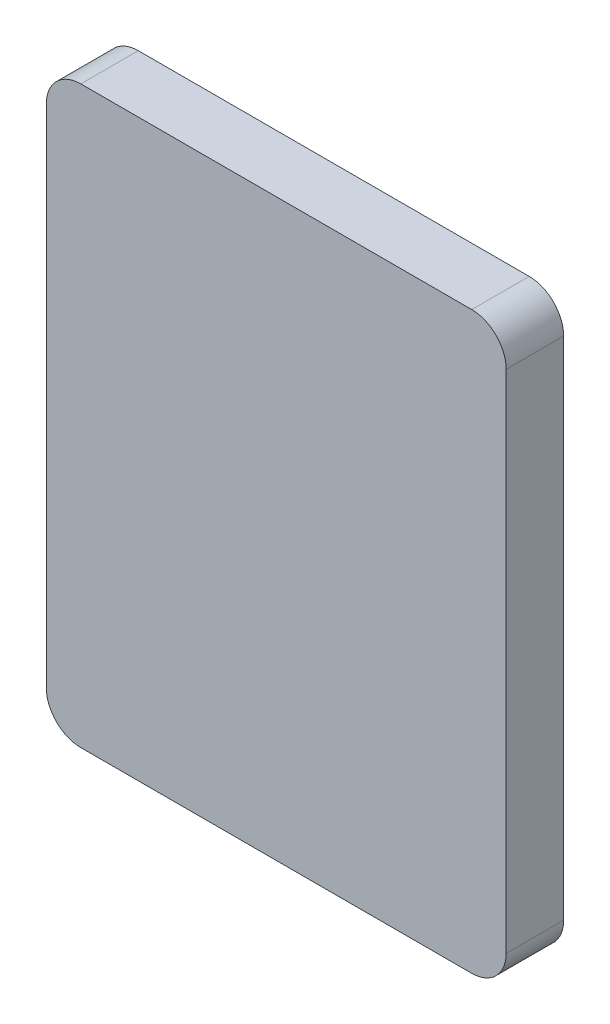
SolidWorks part; units mm, degrees
ref_plane "Front Plane" through (0, 0, 0) normal (0, 0, 1) x (1, 0, 0)
ref_plane "Top Plane" through (0, 0, 0) normal (0, 1, 0) x (1, 0, 0)
ref_plane "Right Plane" through (0, 0, 0) normal (1, 0, 0) x (0, 0, -1)
sketch "Sketch1" plane through (0, 0, 0) normal (0, 0, 1) x (1, 0, 0)
  line L1 (20, -25) -> (-20, -25)
  line L2 (20, -25) -> (20, 25)
  line L3 (20, 25) -> (-20, 25)
  line L4 (-20, -25) -> (-20, 25)
  line L5 (20, -25) -> (-20, 25) construction
  line L6 (20, 25) -> (-20, -25) construction
  point P0 (0, 0)
  dimension "D1" = 50
  dimension "D2" = 40
extrude "Boss-Extrude1" add sketch "Sketch1" along normal mid plane 5
fillet "Fillet1" radius 3 4 edges at (-20, -25, 0) (20, -25, 0) (20, 25, 0) (-20, 25, 0)
